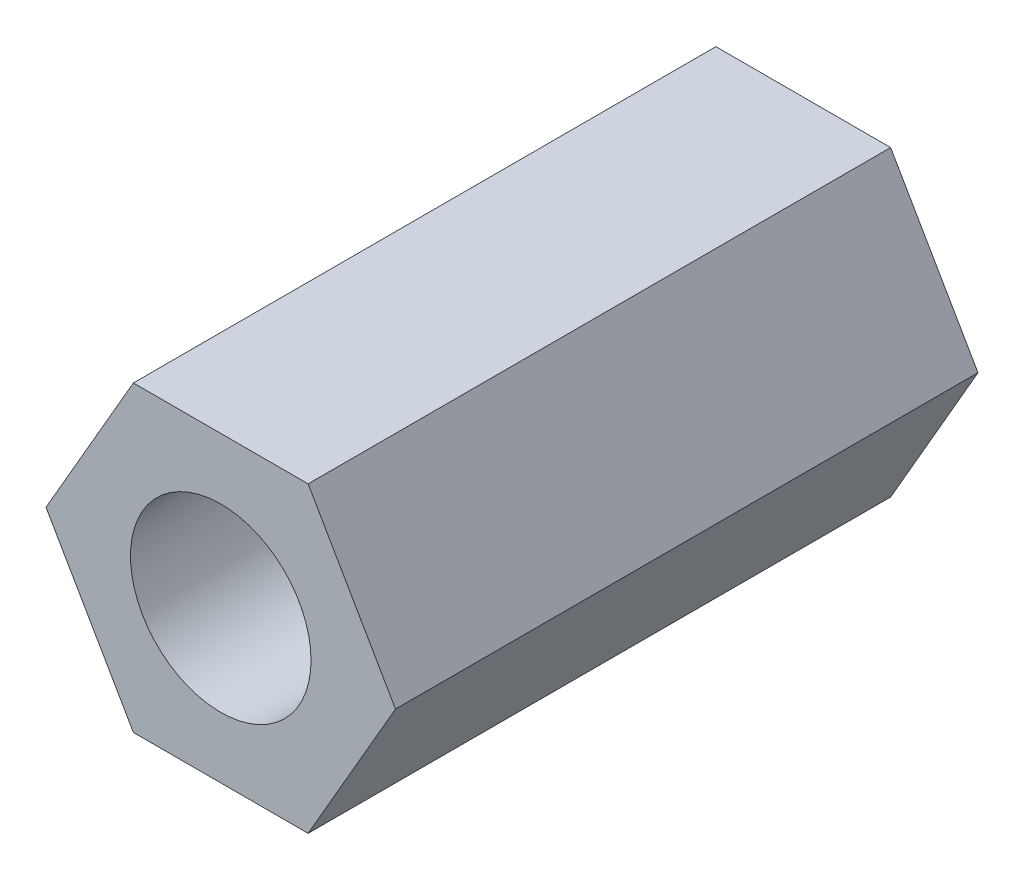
SolidWorks part; units mm, degrees
ref_plane "前视基准面" through (0, 0, 0) normal (0, 0, 1) x (1, 0, 0)
ref_plane "上视基准面" through (0, 0, 0) normal (0, 1, 0) x (1, 0, 0)
ref_plane "右视基准面" through (0, 0, 0) normal (1, 0, 0) x (0, 0, -1)
other "Configuration Table"
sketch "草图1" plane through (0, 0, 0) normal (0, 0, 1) x (1, 0, 0)
  line L7 (3, 0) -> (1.5, 2.5981)
  line L8 (1.5, 2.5981) -> (-1.5, 2.5981)
  line L9 (-1.5, 2.5981) -> (-3, 0)
  line L10 (-3, 0) -> (-1.5, -2.5981)
  line L11 (-1.5, -2.5981) -> (1.5, -2.5981)
  line L12 (1.5, -2.5981) -> (3, 0)
  circle A0 centre (0, 0) radius 2.5981 construction
  circle A1 centre (0, 0) radius 1.55
extrude "凸台-拉伸1" add sketch "草图1" along normal blind 10
